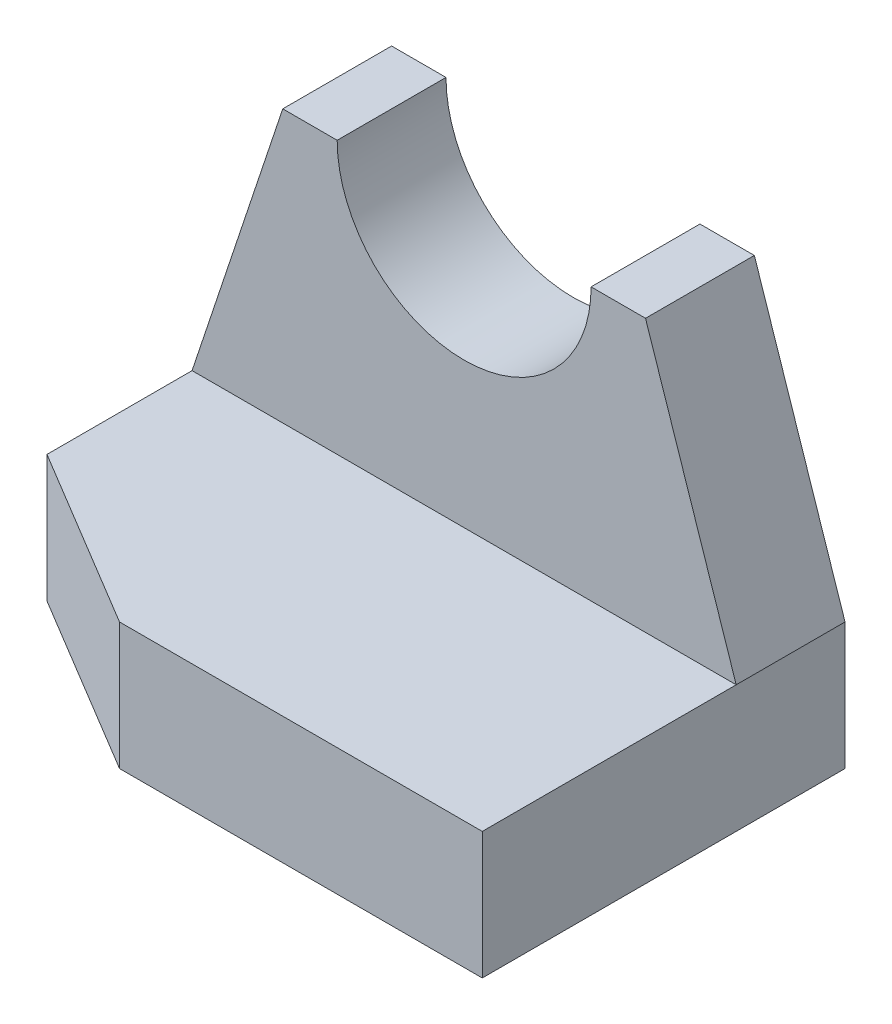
SolidWorks part; units mm, degrees
ref_plane "前视基准面" through (0, 0, 0) normal (0, 0, 1) x (1, 0, 0)
ref_plane "上视基准面" through (0, 0, 0) normal (0, 1, 0) x (1, 0, 0)
ref_plane "右视基准面" through (0, 0, 0) normal (1, 0, 0) x (0, 0, -1)
sketch "草图1" plane through (0, 0, 0) normal (0, 1, 0) x (1, 0, 0)
  line L0 (0, 0) -> (0, 57.004) construction
  line L1 (-15, 0) -> (15, 0)
  line L2 (-15, 0) -> (-15, -14)
  line L3 (-5, -20) -> (15, -20)
  line L4 (15, 0) -> (15, -20)
  line L5 (-15, -14) -> (-5, -20)
  dimension "D1" = 20
  dimension "D2" = 30
extrude "拉伸1" add sketch "草图1" along normal blind 7
sketch "草图2" plane through (0, 0, 0) normal (0, 0, -1) x (-1, 0, 0)
  line L0 (-10, 22) -> (-7, 22)
  line L1 (10, 22) -> (15, 7)
  line L2 (0, 0) -> (0, 33.4778) construction
  line L3 (-10, 22) -> (-15, 7)
  line L4 (7, 22) -> (10, 22)
  line L5 (15, 7) -> (-15, 7)
  arc A0 (-7, 22) -> (7, 22) centre (0, 22) ccw
  point P2 (7, 22)
  dimension "D2" = 14
  dimension "D1" = 3
  dimension "D3" = 22
extrude "拉伸2" add sketch "草图2" against normal blind 6
